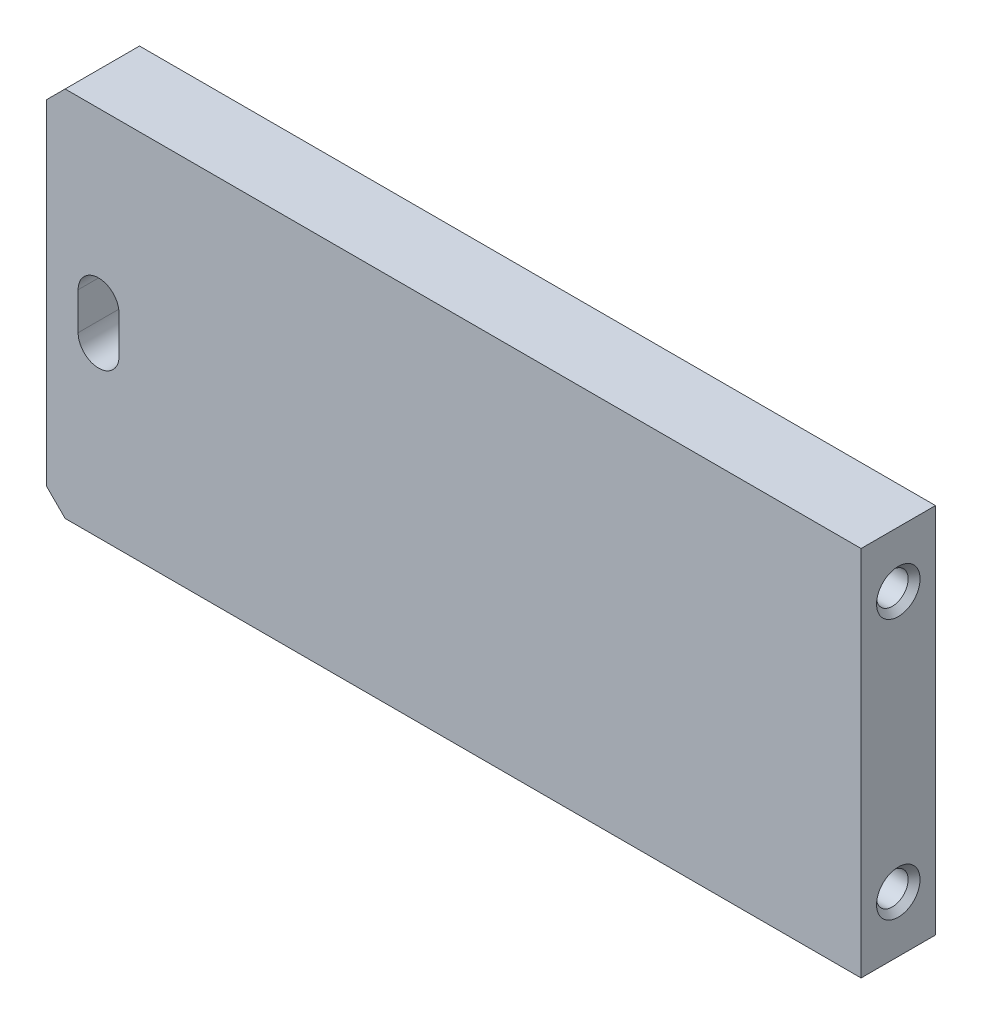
SolidWorks part; units mm, degrees
ref_plane "Спереди" through (0, 0, 0) normal (0, 0, 1) x (1, 0, 0)
ref_plane "Сверху" through (0, 0, 0) normal (0, 1, 0) x (1, 0, 0)
ref_plane "Справа" through (0, 0, 0) normal (1, 0, 0) x (0, 0, -1)
sketch "Эскиз1" plane through (0, 0, 0) normal (0, 0, 1) x (1, 0, 0)
  line L1 (0, 0) -> (219, 0)
  line L2 (0, 0) -> (0, 100)
  line L3 (0, 100) -> (219, 100)
  line L4 (219, 0) -> (219, 100)
  dimension "D1" = 100
  dimension "D2" = 219
extrude "Бобышка-Вытянуть1" add sketch "Эскиз1" along normal blind 20
hole_wizard "Отверстие обработанное метчиком M102" positions "Эскиз4" profile "Эскиз5" tap size "M10" standard "ISO"
sketch "Эскиз4" plane through (219, 0, 0) normal (1, 0, 0) x (0, 0, -1)
  line L0 (-10, 100) -> (-10, 0) construction
  line L1 (-20, 100) -> (0, 100) construction
  line L2 (-20, 0) -> (0, 0) construction
  line L4 (-20, 50) -> (0, 50) construction
  line L5 (-20, 0) -> (-20, 100) construction
  line L6 (0, 0) -> (0, 100) construction
  point P0 (-10, 85)
  point P2 (-10, 15)
  dimension "D1" = 70
sketch "Эскиз5" plane through (219, 85, 10) normal (0, 1, 0) x (0, 0, -1)
  line L0 (0, 0) -> (0, 28.5537)
  line L1 (0, 28.5537) -> (4.25, 26)
  line L2 (4.25, 26) -> (4.25, 0)
  line L5 (4.25, 0) -> (0, 0)
  line L10 (0, 28.5537) -> (-4.25, 26) construction
  line L11 (0, -6.35) -> (0, 107.95) construction
  dimension "Диаметр сверла" = 8.5
  dimension "Глубина сверла" = 26
  dimension "Угол заточки сверла" = 118
chamfer "Фаска1" distance 1.6 angle 45 2 edges at (219, 15, 5.75) (219, 85, 5.75)
hole_wizard "Отверстие обработанное метчиком M103" positions "Эскиз6" profile "Эскиз7" tap size "M10" standard "ISO"
sketch "Эскиз6" plane through (0, 0, 0) normal (-1, 0, 0) x (0, 0, 1)
  line L0 (10, 100) -> (10, 0) construction
  line L1 (20, 100) -> (0, 100) construction
  line L2 (20, 0) -> (0, 0) construction
  line L4 (0, 50) -> (20, 50) construction
  line L5 (0, 100) -> (0, 0) construction
  line L6 (20, 100) -> (20, 0) construction
  point P0 (10, 75)
  point P2 (10, 25)
  dimension "D1" = 50
sketch "Эскиз7" plane through (0, 75, 10) normal (0, 1, 0) x (0, 0, 1)
  line L0 (0, 0) -> (0, 28.5537)
  line L1 (0, 28.5537) -> (4.25, 26)
  line L2 (4.25, 26) -> (4.25, 0)
  line L5 (4.25, 0) -> (0, 0)
  line L10 (0, 28.5537) -> (-4.25, 26) construction
  line L11 (0, -6.35) -> (0, 107.95) construction
  dimension "Диаметр сверла" = 8.5
  dimension "Глубина сверла" = 26
  dimension "Угол заточки сверла" = 118
chamfer "Фаска2" distance 1.6 angle 45 2 edges at (0, 25, 14.25) (0, 75, 14.25)
sketch "Эскиз8" plane through (0, 0, 0) normal (0, 0, -1) x (-1, 0, 0)
  line L0 (-14, 55) -> (-14, 45) construction
  line L1 (-8.5, 55) -> (-8.5, 45)
  line L2 (-19.5, 55) -> (-19.5, 45)
  line L3 (-219, 50) -> (44.1694, 50) construction
  line L4 (-219, 0) -> (-219, 100) construction
  line L5 (0, 100) -> (0, 0) construction
  arc A0 (-8.5, 55) -> (-19.5, 55) centre (-14, 55) ccw
  arc A1 (-19.5, 45) -> (-8.5, 45) centre (-14, 45) ccw
  point P2 (-14, 50)
  point P7 (-14, 60.5)
  point P8 (-14, 39.5)
  dimension "D2" = 5.5
  dimension "D1" = 21
  dimension "D3" = 14
extrude "Вырез-Вытянуть1" cut sketch "Эскиз8" against normal through all
chamfer "Фаска3" distance 5 angle 45 2 edges at (0, 0, 10) (0, 100, 10)
